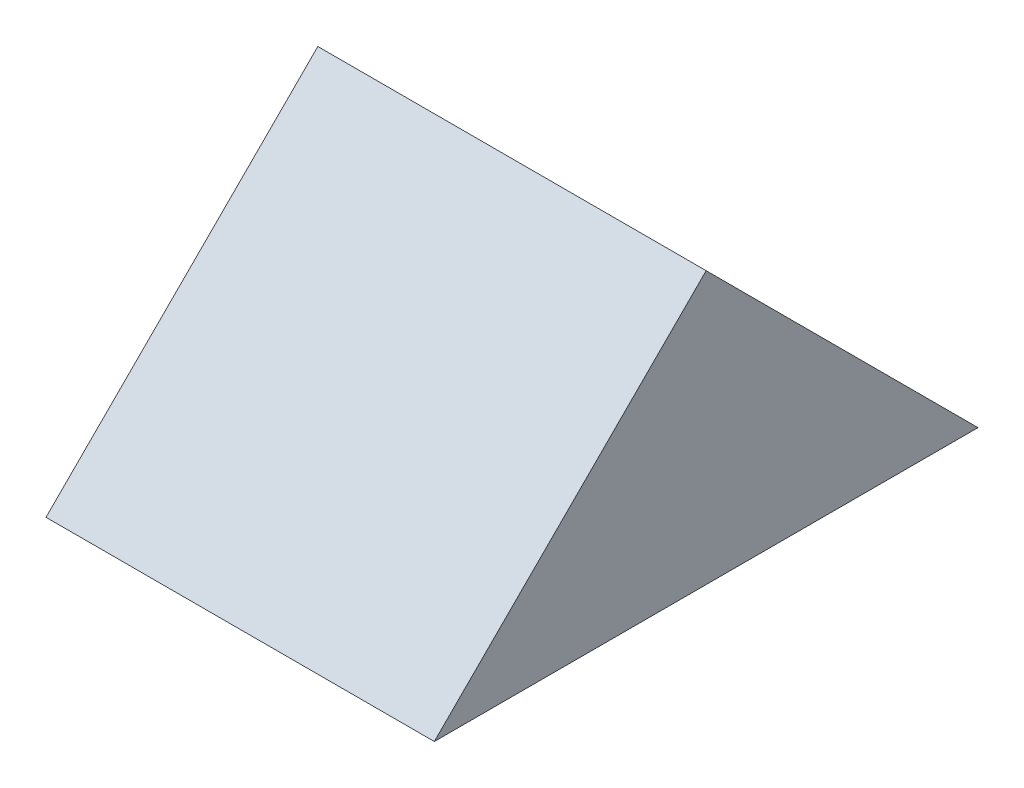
SolidWorks part; units mm, degrees
ref_plane "Front Plane" through (0, 0, 0) normal (0, 0, 1) x (1, 0, 0)
ref_plane "Top Plane" through (0, 0, 0) normal (0, 1, 0) x (1, 0, 0)
ref_plane "Right Plane" through (0, 0, 0) normal (1, 0, 0) x (0, 0, -1)
sketch "Sketch1" plane through (0, 0, 0) normal (1, 0, 0) x (0, 0, -1)
  line L0 (0, 0) -> (17.5, 0)
  line L1 (17.5, 0) -> (0, 17.5)
  line L2 (0, 17.5) -> (-17.5, 0)
  line L3 (-17.5, 0) -> (0, 0)
  dimension "D1" = 45
  dimension "D2" = 90
  dimension "D3" = 17.5
  dimension "D4" = 17.5
extrude "Boss-Extrude1" add sketch "Sketch1" along normal mid plane 25
